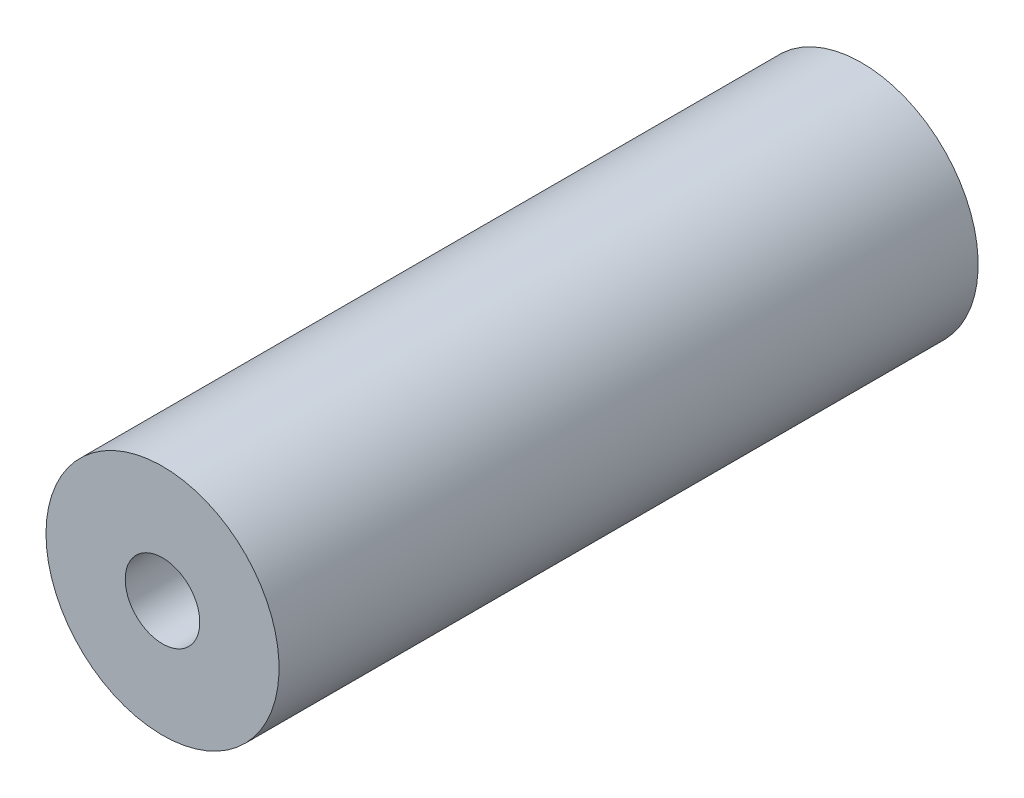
SolidWorks part; units mm, degrees
ref_plane "Front Plane" through (0, 0, 0) normal (0, 0, 1) x (1, 0, 0)
ref_plane "Top Plane" through (0, 0, 0) normal (0, 1, 0) x (1, 0, 0)
ref_plane "Right Plane" through (0, 0, 0) normal (1, 0, 0) x (0, 0, -1)
sketch "Sketch1" plane through (0, 0, 0) normal (0, 0, 1) x (1, 0, 0)
  circle A0 centre (0, 0) radius 1.016
  circle A1 centre (0, 0) radius 3.175
  dimension "D1" = 2.032
  dimension "D2" = 6.35
extrude "Boss-Extrude1" add sketch "Sketch1" along normal blind 19.05
